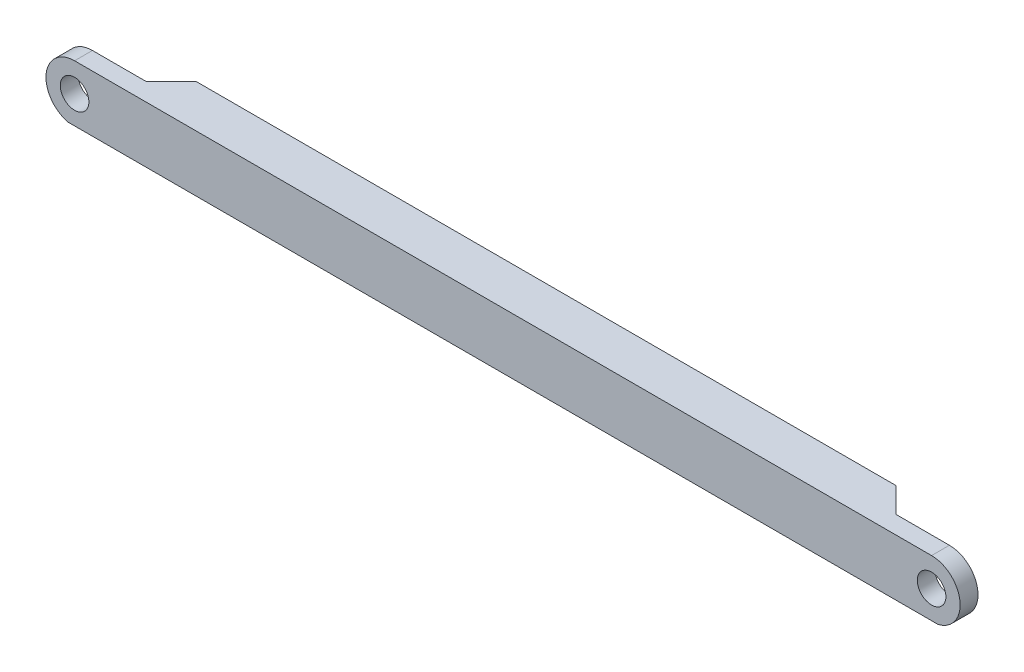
SolidWorks part; units mm, degrees
ref_plane "Plan de face" through (0, 0, 0) normal (0, 0, 1) x (1, 0, 0)
ref_plane "Plan de dessus" through (0, 0, 0) normal (0, 1, 0) x (1, 0, 0)
ref_plane "Plan de droite" through (0, 0, 0) normal (1, 0, 0) x (0, 0, -1)
sketch "Esquisse1" plane through (0, 0, 0) normal (0, 0, 1) x (1, 0, 0)
  line L0 (100, 6) -> (-100, -6) construction
  line L1 (100, 6) -> (-100, 6)
  line L2 (100, 6) -> (100, -6)
  line L3 (100, -6) -> (-100, -6)
  line L4 (-100, 6) -> (-100, -6)
  dimension "D1" = 12
  dimension "D2" = 200
extrude "Boss.-Extru.1" add sketch "Esquisse1" along normal blind 10
sketch "Esquisse2" plane through (0, 0, 10) normal (0, 0, 1) x (1, 0, 0)
  line L0 (-60, -2) -> (60, -2) construction
  line L1 (-60, -2) -> (60, -2)
  line L2 (-60, 6) -> (-100, 6)
  line L3 (-100, 6) -> (-100, -6)
  line L4 (-100, -6) -> (100, -6)
  line L5 (100, -6) -> (100, 6)
  line L6 (100, 6) -> (60, 6)
  arc A0 (60, -2) -> (60, 6) centre (60, 2) ccw construction
  arc A1 (-60, 6) -> (-60, -2) centre (-60, 2) ccw construction
  arc A2 (60, -2) -> (60, 6) centre (60, 2) ccw
  arc A3 (-60, 6) -> (-60, -2) centre (-60, 2) ccw
extrude "Enlèv. mat.-Extru.1" cut sketch "Esquisse2" against normal through all
sketch "Esquisse3" plane through (0, 0, 10) normal (0, 0, 1) x (1, 0, 0)
  line L2 (-60, -2) -> (60, -2)
  line L3 (60, 6) -> (-60, 6)
  line L5 (60, 6) -> (-60, 6)
  line L7 (-60, -2) -> (60, -2)
  arc A2 (60, -2) -> (60, 6) centre (60, 2) ccw
  arc A6 (60, -2) -> (60, 6) centre (60, 2) ccw
  arc A8 (-60, 6) -> (-60, -2) centre (-60, 2) ccw
  arc A9 (-60, 6) -> (-60, -2) centre (-60, 2) ccw
  dimension "D1" = 0
extrude "Enlèv. mat.-Extru.2" cut sketch "Esquisse3" against normal up to surface (7.5 mm away)
sketch "Esquisse6" plane through (0, 0, 0) normal (0, 0, -1) x (-1, 0, 0)
  line L0 (-54, 6) -> (54, 6)
  line L1 (-54, 6) -> (-54, -2)
  line L2 (54, 6) -> (54, -2)
  line L3 (-54, -2) -> (54, -2)
  line L4 (-60, 6) -> (60, 6) construction
  line L5 (-60, -2) -> (60, -2) construction
  line L6 (0, 0) -> (0, -2) construction
  dimension "D1" = 108
extrude "Boss.-Extru.2" add sketch "Esquisse6" along normal blind 3.5
sketch "Esquisse4" plane through (0, 0, 0) normal (0, 0, 1) x (1, 0, 0)
  line L0 (64, 2) -> (-64, 2) construction
  arc A0 (60, -2) -> (60, 6) centre (60, 2) ccw construction
  arc A1 (-60, 6) -> (-60, -2) centre (-60, 2) ccw construction
  circle A2 centre (0, 2) radius 2.6
  dimension "D1" = 5.2
extrude "Enlèv. mat.-Extru.3" cut sketch "Esquisse4" along normal offset from surface 0.9 and the other way through all
pattern_linear "Répétition linéaire1" count 5 spacing 10 along (-1, 0, 0) count 5 spacing 10 along (1, 0, 0) of "Enlèv. mat.-Extru.3"
sketch "Esquisse5" plane through (0, 0, 2.5) normal (0, 0, 1) x (1, 0, 0)
  circle A0 centre (-60, 2) radius 2
  circle A1 centre (60, 2) radius 2
  dimension "D1" = 4
extrude "Enlèv. mat.-Extru.4" cut sketch "Esquisse5" against normal through all
chamfer "Chanfrein1" distance 5 angle 45 2 edges at (54, 2, -3.5) (-54, 2, -3.5)
sketch "Esquisse7" plane through (0, -2, 0) normal (0, -1, 0) x (1, 0, 0)
  line L0 (-84.1141, 14.3593) -> (73.3616, 16.1287)
  line L1 (-84.1141, 14.3593) -> (-83.7894, -14.5376)
  line L2 (73.3616, 16.1287) -> (73.6863, -12.7682)
  line L3 (-83.7894, -14.5376) -> (73.6863, -12.7682)
extrude "Enlèv. mat.-Extru.5" cut sketch "Esquisse7" against normal blind 0.1
